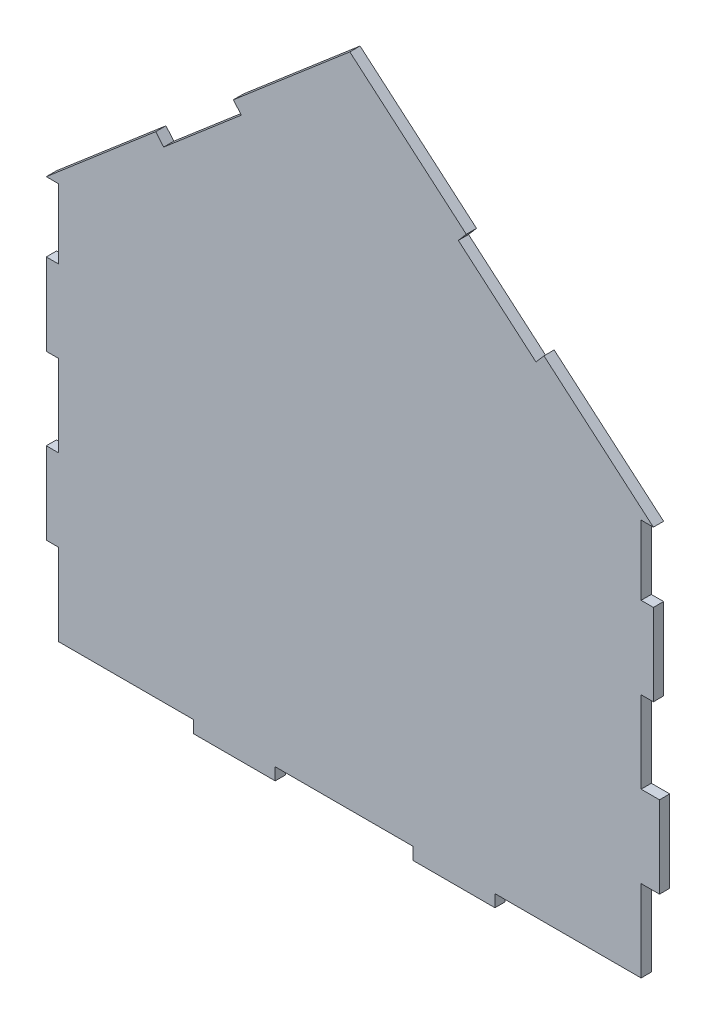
SolidWorks part; units mm, degrees
ref_plane "Alzado" through (0, 0, 0) normal (0, 0, 1) x (1, 0, 0)
ref_plane "Planta" through (0, 0, 0) normal (0, 1, 0) x (1, 0, 0)
ref_plane "Vista lateral" through (0, 0, 0) normal (1, 0, 0) x (0, 0, -1)
sketch "Croquis1" plane through (0, 0, 0) normal (0, 0, 1) x (1, 0, 0)
  line L1 (285, -194) -> (142, -194)
  line L2 (297, 46) -> (297, 126)
  line L5 (-285, -114) -> (-285, -194)
  line L6 (-297, -114) -> (-285, -114)
  line L7 (0, 448.2035) -> (113.9582, 350.6662)
  line L8 (-153, -194) -> (-285, -194)
  line L10 (-153, -194) -> (-153, -206)
  line L11 (-153, -206) -> (-73, -206)
  line L12 (-73, -194) -> (-73, -206)
  line L14 (62, -194) -> (62, -206)
  line L15 (62, -206) -> (142, -206)
  line L16 (142, -194) -> (142, -206)
  line L17 (62, -194) -> (-73, -194)
  line L18 (303, -34) -> (303, -114)
  line L19 (297, 194) -> (285, 194)
  line L21 (297, 126) -> (285, 126)
  line L22 (285, 194) -> (285, 126)
  line L23 (303, -34) -> (285, -34)
  line L25 (297, 46) -> (285, 46)
  line L26 (285, -34) -> (285, 46)
  line L27 (303, -114) -> (285, -114)
  line L30 (285, -114) -> (285, -194)
  line L31 (-285, -194) -> (285, 194) construction
  line L32 (-285, -34) -> (-285, 46)
  line L33 (-297, 46) -> (-285, 46)
  line L34 (-297, -34) -> (-285, -34)
  line L35 (-285, 194) -> (-285, 126)
  line L36 (-297, 126) -> (-285, 126)
  line L37 (-297, 194) -> (-285, 194)
  line L38 (-297, -34) -> (-297, -114)
  line L39 (0, 448.2035) -> (-113.9582, 350.6662)
  line L40 (-297, 46) -> (-297, 126)
  line L46 (189.9304, 285.6413) -> (182.1274, 276.5247)
  line L47 (182.1274, 276.5247) -> (106.1552, 341.5495)
  line L48 (106.1552, 341.5495) -> (113.9582, 350.6662)
  line L49 (0, 448.2035) -> (0, 0) construction
  line L50 (-106.1552, 341.5495) -> (-113.9582, 350.6662)
  line L51 (-182.1274, 276.5247) -> (-106.1552, 341.5495)
  line L52 (-189.9304, 285.6413) -> (-182.1274, 276.5247)
  line L53 (189.9304, 285.6413) -> (297, 194)
  line L54 (-189.9304, 285.6413) -> (-297, 194)
  point P0 (0, 0)
  dimension "D2" = 68
  dimension "D3" = 132
  dimension "D4" = 12
  dimension "D5" = 80
  dimension "D6" = 80
  dimension "D7" = 600
  dimension "D8" = 80
  dimension "D9" = 12
  dimension "D10" = 80
  dimension "D11" = 80
  dimension "D12" = 80
  dimension "D13" = 12
  dimension "D14" = 12
  dimension "D15" = 12
  dimension "D16" = 12
  dimension "D17" = 68
  dimension "D18" = 80
  dimension "D19" = 80
  dimension "D20" = 80
  dimension "D21" = 80
  dimension "D22" = 135
  dimension "D23" = 100
  dimension "D24" = 12
  dimension "D25" = 448.2035
  dimension "D26" = 297
  dimension "D27" = 150
extrude "Saliente-Extruir1" add sketch "Croquis1" along normal blind 10
